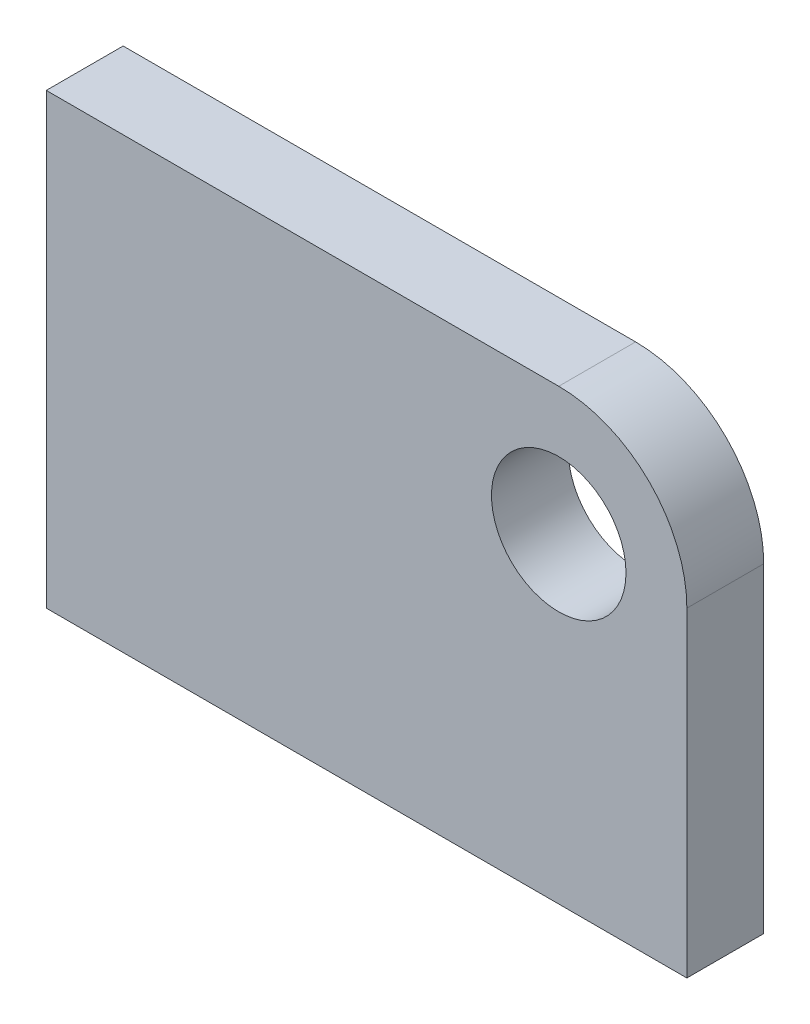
SolidWorks part; units mm, degrees
ref_plane "Face" through (0, 0, 0) normal (0, 0, 1) x (1, 0, 0)
ref_plane "Dessus" through (0, 0, 0) normal (0, 1, 0) x (1, 0, 0)
ref_plane "Droite" through (0, 0, 0) normal (1, 0, 0) x (0, 0, -1)
sketch "Esquisse1" plane through (0, 0, 0) normal (0, 0, 1) x (1, 0, 0)
  line L1 (0, 0) -> (80, 0)
  line L2 (0, 0) -> (0, -70)
  line L3 (0, -70) -> (100, -70)
  line L4 (100, -20) -> (100, -70)
  circle A0 centre (80, -20) radius 10.5
  arc A1 (100, -20) -> (80, 0) centre (80, -20) ccw
  point P9 (100, 0)
  dimension "D3" = 21
  dimension "D6" = 20
  dimension "D1" = 100
  dimension "D2" = 70
  dimension "D4" = 20
  dimension "D5" = 20
extrude "Base-Extrusion" add sketch "Esquisse1" along normal blind 12
